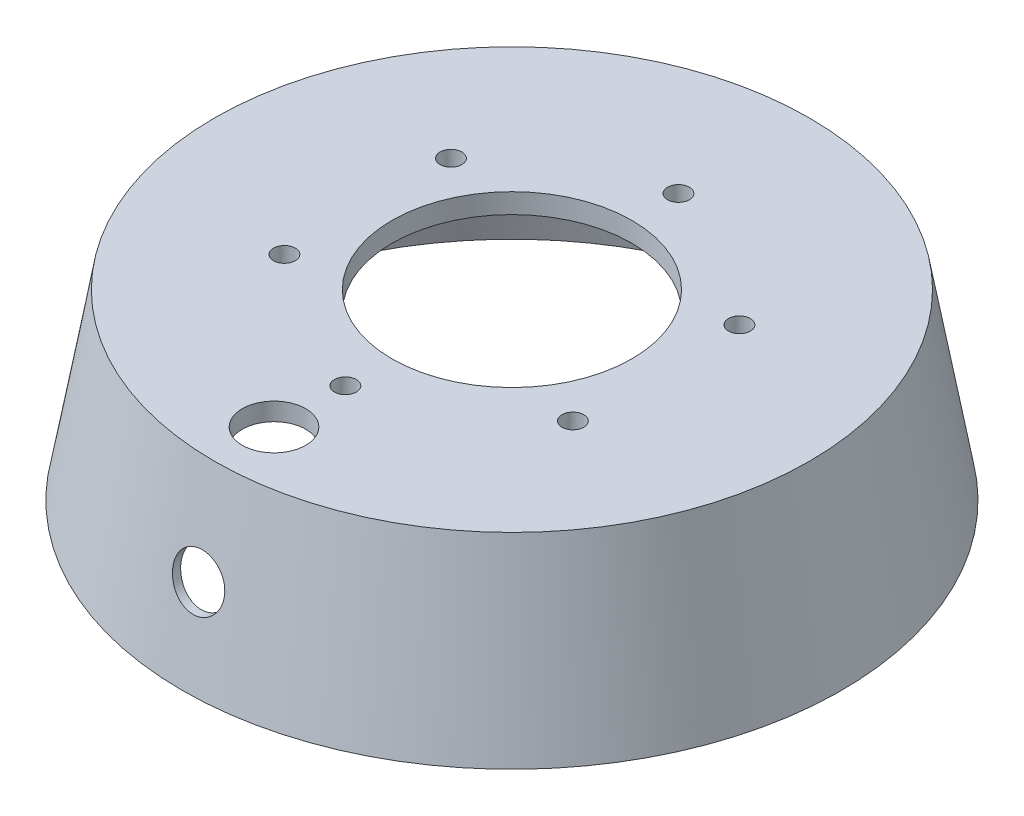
SolidWorks part; units mm, degrees
ref_plane "Plan de face" through (0, 0, 0) normal (0, 0, 1) x (1, 0, 0)
ref_plane "Plan de dessus" through (0, 0, 0) normal (0, 1, 0) x (1, 0, 0)
ref_plane "Plan de droite" through (0, 0, 0) normal (1, 0, 0) x (0, 0, -1)
sketch "Esquisse1" plane through (0, 0, 0) normal (0, 0, 1) x (1, 0, 0)
  line L0 (0, 83.074) -> (0, -82.0342) construction
  line L1 (0, 56.2491) -> (-75, 56.2491)
  line L2 (-75, 56.2491) -> (-83.11, 10.255)
  line L3 (-83.11, 10.255) -> (-81.11, 9.9023)
  line L4 (-81.11, 9.9023) -> (-74.4329, 47.77)
  line L5 (-71.4785, 50.2491) -> (0, 50.2491)
  line L6 (0, 56.2491) -> (0, 50.2491)
  line L7 (-83.11, 10.255) -> (-83.11, -3.8546) construction
  arc A0 (-71.4785, 50.2491) -> (-74.4329, 47.77) centre (-71.4785, 47.2491) ccw
  dimension "D2" = 3
  dimension "D1" = 75
  dimension "D3" = 6
  dimension "D4" = 10
  dimension "D5" = 2
  dimension "D6" = 83.11
revolve "Révolution1" add sketch "Esquisse1" angle 360 about L0
sketch "Esquisse3" plane through (0, 56.2491, 0) normal (0, 1, 0) x (-1, 0, 0)
  circle A0 centre (0, 0) radius 30.25
  dimension "D1" = 60.5
extrude "Enlèv. mat.-Extru.1" cut sketch "Esquisse3" against normal through all
sketch "Esquisse4" plane through (0, 56.2491, 0) normal (0, 1, 0) x (-1, 0, 0)
  line L0 (0, 0) -> (0, -64.9776) construction
  line L1 (0, 0) -> (-66.9808, 0) construction
  line L2 (0, 0) -> (0, 66.2296) construction
  line L3 (0, 0) -> (69.2343, 0) construction
  circle A0 centre (0, 0) radius 42 construction
  circle A2 centre (0, -42) radius 2.75
  dimension "D1" = 84
  dimension "D3" = 5.5
extrude "Trou débouchant de 5,5" cut sketch "Esquisse4" against normal blind 90
pattern_circular "Répétition circulaire1" count 6 every 60 about axis through (0, 0, 0) along (0, 1, 0) of "Trou débouchant de 5,5"
sketch "Esquisse11" plane through (0, 56.2491, 0) normal (0, 1, 0) x (1, 0, 0)
  line L0 (0, 0) -> (0, -72.5807) construction
  circle A0 centre (0, -60) radius 8
  dimension "D1" = 16
  dimension "D2" = 60
extrude "Trou débouchant de 16" cut sketch "Esquisse11" against normal through all
sketch "Esquisse5" plane through (0, 50.2491, 0) normal (0, -1, 0) x (1, 0, 0)
  circle A0 centre (0, 60) radius 12.5
  dimension "D1" = 25
extrude "Lamage de 1,5" cut sketch "Esquisse5" against normal blind 1.5
sketch "Esquisse6" plane through (0, 50.2491, 0) normal (0, -1, 0) x (1, 0, 0)
  circle A0 centre (0, 0) radius 47
  dimension "D1" = 94
extrude "Enlèv. mat.-Extru.4" cut sketch "Esquisse6" against normal blind 1
sketch "Esquisse12" plane through (0, 0, 0) normal (0, 0, 1) x (1, 0, 0)
  line L1 (0, 83.074) -> (0, -82.0342) construction
  line L2 (5.8, 56.2491) -> (-5.8, 56.2491) construction
  circle A0 centre (0, 32.0191) radius 6.5
  dimension "D2" = 13
  dimension "D1" = 24.23
extrude "Enlèv. mat.-Extru.5" cut sketch "Esquisse12" along normal blind 91
